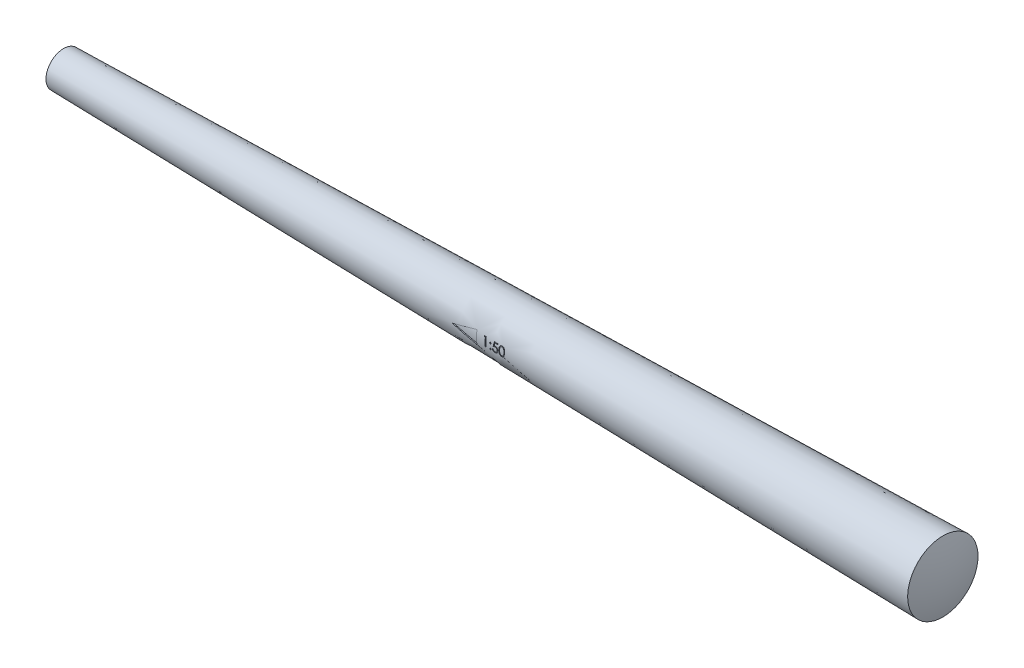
SolidWorks part; units mm, degrees
ref_plane "Front Plane" through (0, 0, 0) normal (0, 0, 1) x (1, 0, 0)
ref_plane "Top Plane" through (0, 0, 0) normal (0, 1, 0) x (1, 0, 0)
ref_plane "Right Plane" through (0, 0, 0) normal (1, 0, 0) x (0, 0, -1)
sketch "Sketch1" plane through (0, 0, 0) normal (1, 0, 0) x (0, 0, -1)
  circle A0 centre (0, 0) radius 2
  dimension "D1" = 4
extrude "Extrude1" add sketch "Sketch1" along normal mid plane 100
draft "Draft1" type of draft neutral plane draft angle 1.146 faces to draft 1 parameters "D1"=1.146
sketch "Sketch2" plane through (0, 0, 0) normal (0, 0, 1) x (1, 0, 0)
  line L0 (-50, 0) -> (-50, 2)
  line L1 (-50, 2) -> (-50, -2) construction
  line L2 (-50, 0) -> (-50.6, 0)
  line L3 (-50.6, 0) -> (-50.6, -3) construction
  line L4 (50, 0) -> (50, 4.0001)
  line L5 (50, -4.0001) -> (50, 4.0001) construction
  line L6 (50, 0) -> (50.6, 0)
  line L7 (50.6, 0) -> (50.6, -3) construction
  line L8 (-50, -2) -> (50, -4.0001) construction
  arc A0 (-50.6, 0) -> (-50, 2) centre (-46.9667, 0) cw
  arc A1 (50.6, 0) -> (50, 4.0001) centre (36.9662, 0) ccw
  point P14 (0, -3)
revolve "Revolve1" add sketch "Sketch2" angle 360 about L2
sketch "Sketch5" plane through (0, 0, 0) normal (0, 0, 1) x (1, 0, 0)
  line L0 (0, 3) -> (0, -3) construction
  line L1 (50, 4.0001) -> (-50, 2) construction
  line L2 (-50, -2) -> (50, -4.0001) construction
ref_plane "Plane2" through (0, 0, 0) normal (-0.02, 0, 0.9998) x (0.9998, 0, 0.02)
sketch "Sketch6" plane through (0, 0, 0) normal (-0.02, 0, 0.9998) x (0.9998, 0, 0.02)
  line L0 (0, 0) -> (0, 0.75)
  line L1 (0, 3) -> (0, -3) construction
  line L2 (0, 0.75) -> (-2.799, 0)
  line L3 (-2.799, 0) -> (0, -0.75)
  line L4 (0, -0.75) -> (0, 0)
  line L5 (0, -0.375) -> (4, -0.375) construction
  text T0 "1:50" font "Century Gothic" height 1
  dimension "D1" = 1.5
  dimension "D2" = 30
  dimension "D3" = 4
wrap "Wrap2" sketch "Sketch6" wrap type deboss source sketch "Sketch6" thickness 0.1 parameters "D1"=0.1
equation "\"D2@Sketch2\" = \"D1@Sketch2\""
